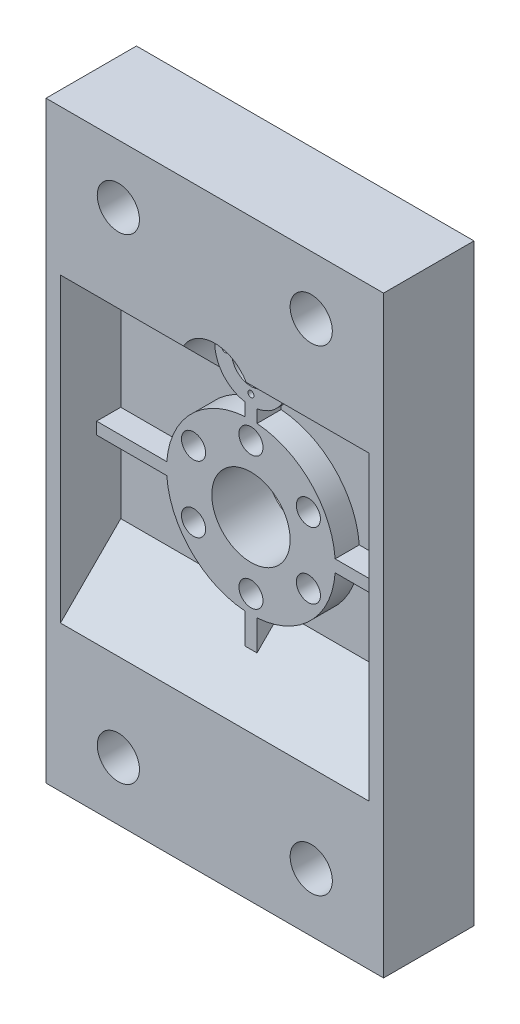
SolidWorks part; units mm, degrees
ref_plane "前视基准面" through (0, 0, 0) normal (0, 0, 1) x (1, 0, 0)
ref_plane "上视基准面" through (0, 0, 0) normal (0, 1, 0) x (1, 0, 0)
ref_plane "右视基准面" through (0, 0, 0) normal (1, 0, 0) x (0, 0, -1)
sketch "草图1" plane through (0, 0, 0) normal (0, 0, 1) x (1, 0, 0)
  line L0 (0, 0) -> (80, 0) construction
  line L1 (140, 246) -> (-140, 246)
  line L2 (140, 246) -> (140, -246)
  line L3 (140, -246) -> (-140, -246)
  line L4 (-140, 246) -> (-140, -246)
  line L5 (140, 246) -> (-140, -246) construction
  line L6 (140, -246) -> (-140, 246) construction
  line L7 (80, 0) -> (80, 197.5) construction
  line L8 (0, 0) -> (0, 110) construction
  circle A0 centre (0, 0) radius 32.5
  circle A1 centre (80, 197.5) radius 17.5
  circle A2 centre (80, -197.5) radius 17.5
  circle A3 centre (-80, -197.5) radius 17.5
  circle A4 centre (-80, 197.5) radius 17.5
  circle A5 centre (0, 110) radius 16
  point P0 (0, 0)
  dimension "D1" = 492
  dimension "D2" = 280
extrude "凸台-拉伸1" add sketch "草图1" along normal blind 75
sketch "草图2" plane through (0, 0, 0) normal (0, 0, -1) x (-1, 0, 0)
  line L0 (-80, 197.5) -> (-80, 234) construction
  line L1 (-80, 234) -> (-128, 234) construction
  line L4 (-128, 234) -> (-128, 149)
  line L5 (-128, 149) -> (-6, 149)
  line L6 (-6, 149) -> (-6, 234)
  line L7 (-6, 234) -> (-128, 234)
  line L8 (0, 0) -> (-102.5441, 0) construction
  line L9 (0, 0) -> (0, -147.3925) construction
  line L10 (128, 234) -> (128, 149)
  line L11 (6, 234) -> (128, 234)
  line L12 (128, 149) -> (6, 149)
  line L13 (6, 149) -> (6, 234)
  line L14 (-128, -234) -> (-128, -149)
  line L15 (-6, -234) -> (-128, -234)
  line L16 (-128, -149) -> (-6, -149)
  line L17 (-6, -149) -> (-6, -234)
  line L18 (6, -149) -> (6, -234)
  line L19 (128, -234) -> (128, -149)
  line L20 (6, -234) -> (128, -234)
  line L21 (128, -149) -> (6, -149)
extrude "切除-拉伸1" cut sketch "草图2" against normal blind 50 contours L19 L21 L18 L20 M1 | L17 L16 L14 L15 M2 | L13 L12 L10 L11 M10 | L6 L7 L4 L5 M8
sketch "草图4" plane through (6, 0, 0) normal (1, 0, 0) x (0, 0, -1)
  line L0 (0, 246) -> (0, -246) construction
  line L1 (-50, 149) -> (0, 149) construction
  line L2 (-50, -149) -> (0, -149) construction
  line L3 (0, 149) -> (0, 99)
  line L4 (-50, 149) -> (0, 149)
  line L5 (-50, -149) -> (0, -149)
  line L6 (-50, -150.3054) -> (0, -100.3054)
  line L7 (-50, -149) -> (-50, -234) construction
  line L8 (-50, 149) -> (0, 99)
  line L9 (0, -100.3054) -> (0, -149)
extrude "切除-拉伸3" cut sketch "草图4" along normal up to surface (122 mm away) contours L4 L8 L3 | L9 L6 M2
sketch "草图5" plane through (-128, 0, 0) normal (1, 0, 0) x (0, 0, -1)
  line L0 (0, 246) -> (0, -246) construction
  line L1 (-50, 149) -> (0, 99) construction
  line L2 (-48.6946, -149) -> (0, -100.3054) construction
  line L3 (-50, -149) -> (0, -149) construction
  line L4 (-50, 149) -> (0, 149) construction
  line L5 (0, 149) -> (0, 99)
  line L6 (-50, 149) -> (0, 99)
  line L7 (-48.6946, -149) -> (0, -100.3054)
  line L8 (-50, -149) -> (0, -149)
  line L9 (-50, 149) -> (0, 149)
  line L10 (0, -100.3054) -> (0, -149)
extrude "切除-拉伸4" cut sketch "草图5" along normal up to surface (122 mm away) contours L6 L5 M4 | L10 L7 L8
sketch "草图6" plane through (0, 0, 0) normal (0, 0, -1) x (-1, 0, 0)
  line L0 (0, 0) -> (0, 110) construction
  line L1 (-6, 124.8324) -> (-6, 234) construction
  line L2 (6, 124.8324) -> (6, 234) construction
  line L3 (-128, 99) -> (-11.619, 99) construction
  line L4 (11.619, 99) -> (128, 99) construction
  line L5 (-6, 124.8324) -> (-6, 139.3939)
  line L6 (6, 124.8324) -> (6, 139.3939)
  line L7 (-27.9106, 99) -> (-11.619, 99)
  line L8 (11.619, 99) -> (27.9106, 99)
  arc A0 (27.9106, 99) -> (6, 139.3939) centre (0, 110) ccw
  circle A1 centre (0, 110) radius 16
  arc A2 (-6, 139.3939) -> (-27.9106, 99) centre (0, 110) ccw
extrude "凸台-拉伸2" add sketch "草图6" against normal up to surface (25.8324 mm away) contours A1 A0 M12 M19 | A2 A1 M17 M14
sketch "草图7" plane through (0, 0, 75) normal (0, 0, 1) x (1, 0, 0)
  line L1 (-128, -75) -> (128, -75)
  line L2 (-128, -75) -> (-128, 75)
  line L3 (-128, 75) -> (128, 75)
  line L4 (128, -75) -> (128, 75)
  line L5 (-128, -75) -> (128, 75) construction
  line L6 (-128, 75) -> (128, -75) construction
  point P0 (0, 0)
  dimension "D1" = 150
  dimension "D2" = 256
extrude "切除-拉伸5" cut sketch "草图7" against normal blind 50
sketch "草图8" plane through (128, 0, 0) normal (-1, 0, 0) x (0, 0, 1)
  line L0 (25, -75) -> (75, -75) construction
  line L1 (25, 75) -> (75, 75) construction
  line L2 (25, -75) -> (75, -75)
  line L3 (25, 75) -> (75, 75)
  line L4 (25, 75) -> (75, 125)
  line L5 (25, -75) -> (75, -125)
  line L6 (75, -246) -> (75, 246) construction
  line L7 (75, -125) -> (75, -75)
  line L8 (75, 75) -> (75, 125)
extrude "切除-拉伸6" cut sketch "草图8" along normal up to surface (256 mm away)
sketch "草图9" plane through (0, 0, 75) normal (0, 0, 1) x (1, 0, 0)
  circle A0 centre (0, 110) radius 30
  circle A1 centre (0, 110) radius 16
extrude "切除-拉伸7" cut sketch "草图9" against normal blind 30
sketch "草图10" plane through (0, 0, 45) normal (0, 0, 1) x (1, 0, 0)
  line L0 (-5.5678, 95) -> (-25.9808, 95) construction
  line L1 (25.9808, 95) -> (5.5678, 95) construction
  line L2 (-5.5678, 95) -> (-25.9808, 95)
  line L3 (25.9808, 95) -> (5.5678, 95)
  arc A0 (-25.9808, 95) -> (25.9808, 95) centre (0, 110) ccw
  arc A1 (-5.5678, 95) -> (5.5678, 95) centre (0, 110) ccw
extrude "凸台-拉伸5" add sketch "草图10" against normal up to next
sketch "草图11" plane through (0, 0, 25) normal (0, 0, 1) x (1, 0, 0)
  circle A0 centre (0, 0) radius 32.5 construction
  circle A1 centre (0, 0) radius 32.5
  circle A2 centre (0, 0) radius 70
extrude "凸台-拉伸6" add sketch "草图11" along normal blind 20
sketch "草图12" plane through (0, 0, 45) normal (0, 0, 1) x (1, 0, 0)
  line L0 (-128, -75) -> (128, -75) construction
  line L2 (-5, -75) -> (5, -75)
  line L4 (0.2615, -5) -> (-0.2615, -5)
  line L5 (128, -5) -> (69.8212, -5)
  line L6 (128, -5) -> (128, 5)
  line L7 (128, 5) -> (69.8212, 5)
  line L8 (-128, -5) -> (-128, 5)
  line L9 (128, -5) -> (-128, 5) construction
  line L10 (128, 5) -> (69.9467, 2.7323) construction
  line L12 (5, -75) -> (5, -69.8212)
  line L14 (-5, -75) -> (-5, -69.8212)
  line L15 (5, -95.6012) -> (-5, 95.6012) construction
  line L16 (5, 95.6012) -> (-5, -95.6012) construction
  line L17 (5, 0.1953) -> (-128, -5) construction
  line L18 (0.2615, 5) -> (-0.2615, 5)
  line L19 (5, 69.8212) -> (5, 80.4196)
  line L20 (-5, 69.8212) -> (-5, 80.4196)
  line L22 (5, -0.1953) -> (5, 0.1953)
  line L23 (-69.8212, -5) -> (-128, -5)
  line L24 (-69.8212, 5) -> (-128, 5)
  circle A0 centre (0, 0) radius 70 construction
  arc A1 (-5, -69.8212) -> (5, -69.8212) centre (0, 0) ccw
  arc A2 (69.8212, -5) -> (69.8212, 5) centre (0, 0) ccw
  arc A3 (5, 69.8212) -> (-5, 69.8212) centre (0, 0) ccw
  arc A4 (-69.8212, 5) -> (-69.8212, -5) centre (0, 0) ccw
  arc A5 (-25.9808, 95) -> (25.9808, 95) centre (0, 110) ccw construction
  arc A6 (-5, 80.4196) -> (5, 80.4196) centre (0, 110) ccw
  point P4 (0, 0)
  point P10 (0, 0)
  dimension "D1" = 256
  dimension "D2" = 10
  dimension "D3" = 10
extrude "凸台-拉伸7" add sketch "草图12" against normal up to surface (20 mm away) contours A6 L20 L19 M4 | L6 L7 L5 M4 | L14 L2 L12 M4 | L24 L8 L23 M4
sketch "草图13" plane through (0, -75, 0) normal (0, -1, 0) x (1, 0, 0)
  line L4 (-5, 45) -> (-5, 25)
  line L5 (-5, 25) -> (5, 25)
  line L6 (5, 25) -> (5, 45)
  line L7 (5, 45) -> (-5, 45)
  line L8 (-5, 45) -> (-5, 25)
  line L9 (-5, 25) -> (5, 25)
  line L10 (5, 25) -> (5, 45)
  line L11 (5, 45) -> (-5, 45)
  dimension "D1" = 0
extrude "凸台-拉伸8" add sketch "草图13" along normal up to next
sketch "草图14" plane through (0, 0, 45) normal (0, 0, 1) x (1, 0, 0)
  line L0 (0, 110) -> (0, 88.5) construction
  circle A0 centre (0, 88.5) radius 2.5
  circle A1 centre (-21.5, 110) radius 2.5
  circle A2 centre (0, 131.5) radius 2.5
  circle A3 centre (21.5, 110) radius 2.5
  point P14 (0, 110)
  dimension "D1" = 4
extrude "切除-拉伸8" cut sketch "草图14" against normal blind 13
sketch "草图15" plane through (0, 0, 45) normal (0, 0, 1) x (1, 0, 0)
  line L0 (0, 0) -> (0, 55) construction
  circle A0 centre (0, 55) radius 6.5
  circle A1 centre (47.6314, 27.5) radius 6.5
  circle A2 centre (47.6314, -27.5) radius 6.5
  circle A3 centre (0, -55) radius 6.5
  circle A4 centre (-47.6314, -27.5) radius 6.5
  circle A5 centre (-47.6314, 27.5) radius 6.5
  point P16 (0, 0)
  dimension "D1" = 6
extrude "切除-拉伸9" cut sketch "草图15" against normal through all
sketch "草图16" plane through (0, 0, 45) normal (0, 0, 1) x (1, 0, 0)
  circle A0 centre (0, 55) radius 10
  circle A1 centre (0, -55) radius 10
  circle A2 centre (47.6314, 27.5) radius 10
  circle A3 centre (47.6314, -27.5) radius 10
  circle A4 centre (-47.6314, 27.5) radius 10
  circle A5 centre (-47.6314, -27.5) radius 10
extrude "切除-拉伸10" cut sketch "草图16" against normal blind 15
